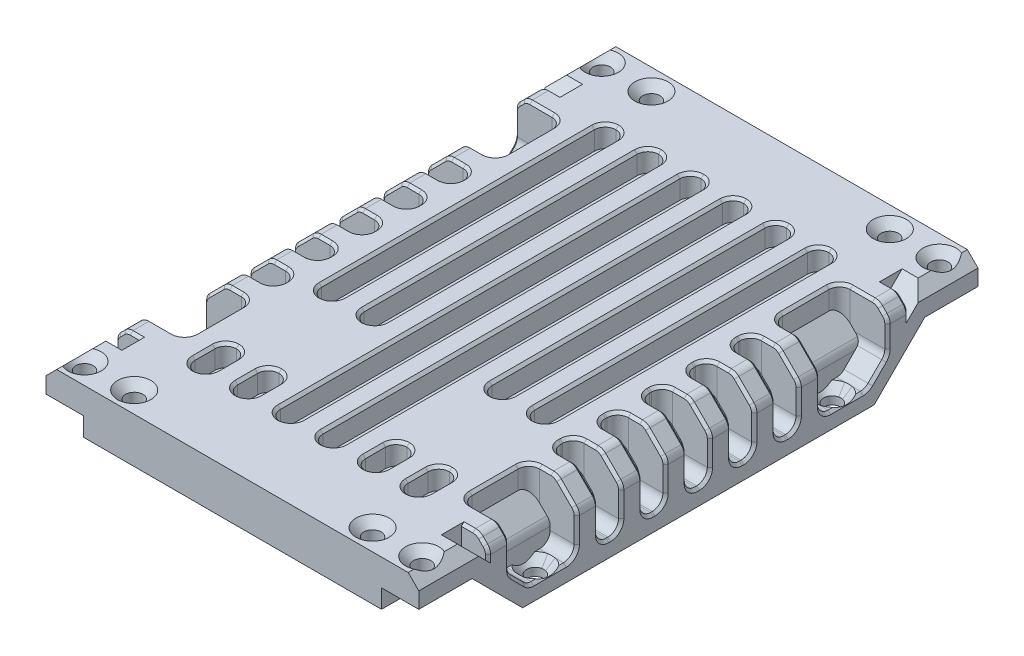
SolidWorks part; units mm, degrees
ref_plane "Front Plane" through (0, 0, 0) normal (0, 0, 1) x (1, 0, 0)
ref_plane "Top Plane" through (0, 0, 0) normal (0, 1, 0) x (1, 0, 0)
ref_plane "Right Plane" through (0, 0, 0) normal (1, 0, 0) x (0, 0, -1)
sketch "Sketch1" plane through (0, 0, 0) normal (0, 0, 1) x (1, 0, 0)
  line L0 (7, 0) -> (7, 6)
  line L1 (0, 0) -> (7, 0)
  line L2 (0, 0) -> (0, 14.5)
  line L3 (0, 14.5) -> (70, 14.5)
  line L4 (70, 0) -> (70, 14.5)
  line L5 (7, 6) -> (63, 6)
  line L6 (63, 6) -> (63, 0)
  line L7 (63, 0) -> (70, 0)
  dimension "D1" = 6
  dimension "D2" = 8.5
  dimension "D3" = 7
  dimension "D4" = 7
  dimension "D5" = 70
extrude "Boss-Extrude1" add sketch "Sketch1" along normal blind 105
sketch "Sketch2" plane through (70, 0, 0) normal (1, 0, 0) x (0, 0, -1)
  line L0 (0, 9.5) -> (-10, 9.5)
  line L1 (-10, 9.5) -> (-19.5, 0)
  line L2 (-19.5, 0) -> (-85.5, 0)
  line L3 (-85.5, 0) -> (-95, 9.5)
  line L4 (-95, 9.5) -> (-105, 9.5)
  line L5 (-105, 9.5) -> (-105, 14.5)
  line L6 (-105, 14.5) -> (0, 14.5)
  line L7 (0, 14.5) -> (0, 9.5)
  line L8 (0, 0) -> (-105, 14.5)
extrude "Cut-Extrude1" cut sketch "Sketch2" against normal through all contours L3 L4 M5 M6 | L8 L0 L1 M3 | L8 L1 M6
sketch "Sketch3" plane through (70, 0, 0) normal (1, 0, 0) x (0, 0, -1)
  line L0 (-9.2426, 14.5) -> (-20.7426, 3)
  line L1 (-20.7426, 3) -> (-84.2574, 3)
  line L2 (-84.2574, 3) -> (-95.7574, 14.5)
  line L3 (-95.7574, 14.5) -> (-9.2426, 14.5)
  line L5 (-105, 14.5) -> (0, 14.5) construction
  line L6 (-85.5, 0) -> (-95, 9.5) construction
  line L7 (-85.5, 0) -> (-19.5, 0) construction
  line L8 (-10, 9.5) -> (-19.5, 0) construction
extrude "Cut-Extrude2" cut sketch "Sketch3" against normal blind 5 contours L2 L3 L0 L1
ref_plane "Plane1" through (35, 0, 0) normal (1, 0, 0) x (0, 0, -1)
mirror "Mirror1" about plane through (35, 0, 0) normal (1, 0, 0) of "Cut-Extrude2"
sketch "Sketch4" plane through (0, 14.5, 0) normal (0, 1, 0) x (1, 0, 0)
  line L2 (0, -13) -> (0, -92)
  line L3 (0, -92) -> (70, -92)
  line L4 (70, -13) -> (70, -92)
  line L5 (70, -84.2574) -> (70, -95.7574) construction
  line L7 (70, -105) -> (0, -105) construction
  line L9 (9, -92) -> (13, -92)
  line L10 (9, -92) -> (9, -13)
  line L12 (13, -92) -> (13, -13)
  line L13 (17, -92) -> (17, -13)
  line L14 (21, -92) -> (21, -13)
  line L15 (25, -92) -> (25, -13)
  line L16 (29, -92) -> (29, -13)
  line L17 (33, -92) -> (33, -13)
  line L18 (37, -92) -> (37, -13)
  line L19 (41, -92) -> (41, -13)
  line L20 (45, -92) -> (45, -13)
  line L21 (49, -92) -> (49, -13)
  line L22 (53, -92) -> (53, -13)
  line L23 (57, -92) -> (57, -13)
  line L24 (61, -92) -> (61, -13)
  line L26 (61, -13) -> (70, -13)
  line L27 (0, -13) -> (9, -13)
  line L28 (0, -9.2426) -> (0, -20.7426) construction
  line L29 (9, -13) -> (61, -13)
  dimension "D1" = 4
  dimension "D2" = 13
  dimension "D4" = 4
  dimension "D3" = 7
extrude "Cut-Extrude3" cut sketch "Sketch4" against normal blind 4 contours L27 L3 L10 M3 | L29 L12 L3 L13 | L29 L14 L3 L15 | L29 L16 L3 L17 | L29 L18 L3 L19 | L29 L20 L3 L21 | L29 L22 L3 L23 | L26 L24 L3 M9
sketch "Sketch5" plane through (0, 14.5, 0) normal (0, 1, 0) x (1, 0, 0)
  line L1 (29, -84.2574) -> (13, -84.2574)
  line L2 (29, -84.2574) -> (29, -68.2574)
  line L3 (29, -68.2574) -> (13, -68.2574)
  line L4 (13, -84.2574) -> (13, -68.2574)
  line L6 (41, -68.2574) -> (57, -68.2574)
  line L7 (41, -68.2574) -> (41, -84.2574)
  line L8 (41, -84.2574) -> (57, -84.2574)
  line L9 (57, -68.2574) -> (57, -84.2574)
  line L10 (13, -92) -> (13, -13) construction
  line L11 (41, -92) -> (41, -13) construction
  line L12 (57, -92) -> (57, -13) construction
  line L13 (29, -92) -> (29, -13) construction
  line L14 (5, -84.2574) -> (0, -84.2574) construction
extrude "Boss-Extrude2" add sketch "Sketch5" against normal up to surface (4 mm away)
sketch "Sketch6" plane through (0, 14.5, 0) normal (0, 1, 0) x (1, 0, 0)
  line L0 (70, -84.2574) -> (70, -95.7574) construction
  line L1 (61, -92) -> (70, -92)
  line L2 (61, -92) -> (61, -88)
  line L3 (61, -88) -> (70, -88)
  line L4 (70, -92) -> (70, -88)
  line L5 (61, -83.6667) -> (70, -83.6667)
  line L6 (70, -83.6667) -> (70, -79.6667)
  line L7 (61, -79.6667) -> (70, -79.6667)
  line L8 (61, -83.6667) -> (61, -79.6667)
  line L9 (61, -75.3333) -> (70, -75.3333)
  line L10 (70, -75.3333) -> (70, -71.3333)
  line L11 (61, -71.3333) -> (70, -71.3333)
  line L12 (61, -75.3333) -> (61, -71.3333)
  line L13 (61, -67) -> (70, -67)
  line L14 (70, -67) -> (70, -63)
  line L15 (61, -63) -> (70, -63)
  line L16 (61, -67) -> (61, -63)
  line L17 (61, -58.6667) -> (70, -58.6667)
  line L18 (70, -58.6667) -> (70, -54.6667)
  line L19 (61, -54.6667) -> (70, -54.6667)
  line L20 (61, -58.6667) -> (61, -54.6667)
  line L21 (61, -50.3333) -> (70, -50.3333)
  line L22 (70, -50.3333) -> (70, -46.3333)
  line L23 (61, -46.3333) -> (70, -46.3333)
  line L24 (61, -50.3333) -> (61, -46.3333)
  line L25 (61, -42) -> (70, -42)
  line L26 (70, -42) -> (70, -38)
  line L27 (61, -38) -> (70, -38)
  line L28 (61, -42) -> (61, -38)
  line L29 (61, -33.6667) -> (70, -33.6667)
  line L30 (70, -33.6667) -> (70, -29.6667)
  line L31 (61, -29.6667) -> (70, -29.6667)
  line L32 (61, -33.6667) -> (61, -29.6667)
  line L33 (61, -25.3333) -> (70, -25.3333)
  line L34 (70, -25.3333) -> (70, -21.3333)
  line L35 (61, -21.3333) -> (70, -21.3333)
  line L36 (61, -25.3333) -> (61, -21.3333)
  line L37 (61, -17) -> (70, -17)
  line L38 (70, -17) -> (70, -13)
  line L39 (61, -13) -> (70, -13)
  line L40 (61, -17) -> (61, -13)
  line L41 (61, -13) -> (65, -13) construction
  dimension "D1" = 4
  dimension "D2" = 10
extrude "Boss-Extrude3" add sketch "Sketch6" against normal up to next
mirror "Mirror2" about plane through (35, 0, 0) normal (1, 0, 0) of "Boss-Extrude3"
chamfer "Chamfer1" distance 4 angle 45 26 edges at (65, 10.5, 23.3333) (70, 14.5, 31.6667) (65, 10.5, 35.8333) (70, 14.5, 40) (65, 10.5, 44.1667) (70, 14.5, 48.3333) (65, 10.5, 52.5) (70, 14.5, 56.6667) (65, 10.5, 69.1667) (65, 10.5, 81.6667) (65, 10.5, 60.8333) (70, 14.5, 65) (70, 14.5, 73.3333) (5, 10.5, 23.3333) (0, 14.5, 31.6667) (5, 10.5, 35.8333) (0, 14.5, 40) (5, 10.5, 44.1667) (0, 14.5, 48.3333) (5, 10.5, 52.5) (0, 14.5, 56.6667) (5, 10.5, 60.8333) (0, 14.5, 65) (5, 10.5, 69.1667) (0, 14.5, 73.3333) (5, 10.5, 81.6667)
chamfer "Chamfer2" distance 2 angle 45 8 edges at (70, 14.5, 100.3787) (70, 14.5, 90) (70, 14.5, 15) (70, 14.5, 4.6213) (0, 14.5, 15) (0, 14.5, 90) (0, 14.5, 100.3787) (0, 14.5, 4.6213)
fillet "Fillet1" radius 2 46 edges at (2.5, 3, 84.2574) (2.6213, 6.7426, 88) (0, 12.5, 90) (2, 14.5, 90) (9, 12.5, 88) (9, 12.5, 75.3333) (2.5, 3, 75.3333) (9, 12.5, 67) (2.5, 3, 67) (2.5, 3, 71.3333) (0, 10.5, 73.3333) (4, 14.5, 73.3333) (9, 12.5, 71.3333) (4, 14.5, 65) (0, 10.5, 65) (9, 12.5, 63) (2.5, 3, 63) (2.5, 3, 54.6667) (9, 12.5, 54.6667) (9, 12.5, 46.3333) (2.5, 3, 46.3333) (9, 12.5, 58.6667) (2.5, 3, 58.6667) (4, 14.5, 56.6667) (0, 10.5, 56.6667) (4, 14.5, 48.3333) (0, 10.5, 48.3333) (2.5, 3, 50.3333) (9, 12.5, 50.3333) (9, 12.5, 42) (2.5, 3, 42) (2.5, 3, 33.6667) (2.5, 3, 38) (2.5, 3, 29.6667) (2.5, 3, 20.7426) (2.6213, 6.7426, 17) (9, 12.5, 17) (9, 12.5, 29.6667) (9, 12.5, 33.6667) (9, 12.5, 38) (0, 10.5, 40) (4, 14.5, 40) (0, 10.5, 31.6667) (2, 14.5, 15) (0, 12.5, 15) (4, 14.5, 31.6667)
fillet "Fillet2" radius 2 40 edges at (53, 12.5, 68.2574) (45, 12.5, 68.2574) (37, 12.5, 92) (29, 12.5, 92) (57, 12.5, 68.2574) (49, 12.5, 68.2574) (41, 12.5, 92) (33, 12.5, 92) (17, 12.5, 68.2574) (25, 12.5, 68.2574) (21, 12.5, 68.2574) (13, 12.5, 68.2574) (57, 12.5, 13) (49, 12.5, 13) (41, 12.5, 13) (33, 12.5, 13) (25, 12.5, 13) (17, 12.5, 13) (13, 12.5, 13) (21, 12.5, 13) (53, 12.5, 13) (45, 12.5, 13) (37, 12.5, 13) (29, 12.5, 13) (21, 12.5, 92) (13, 12.5, 92) (53, 12.5, 92) (45, 12.5, 92) (13, 12.5, 84.2574) (21, 12.5, 84.2574) (53, 12.5, 84.2574) (45, 12.5, 84.2574) (57, 12.5, 84.2574) (49, 12.5, 84.2574) (25, 12.5, 84.2574) (17, 12.5, 84.2574) (57, 12.5, 92) (49, 12.5, 92) (25, 12.5, 92) (17, 12.5, 92)
fillet "Fillet3" radius 2 46 edges at (70, 10.5, 65) (61, 12.5, 63) (67.5, 3, 63) (61, 12.5, 71.3333) (67.5, 3, 71.3333) (61, 12.5, 33.6667) (67.5, 3, 33.6667) (67.5, 3, 42) (67.5, 3, 50.3333) (61, 12.5, 50.3333) (61, 12.5, 42) (61, 12.5, 38) (61, 12.5, 46.3333) (61, 12.5, 54.6667) (67.5, 3, 54.6667) (67.5, 3, 46.3333) (67.5, 3, 38) (68, 14.5, 15) (70, 12.5, 15) (67.5, 3, 29.6667) (61, 12.5, 29.6667) (61, 12.5, 17) (67.3787, 6.7426, 17) (67.5, 3, 20.7426) (70, 10.5, 31.6667) (66, 14.5, 31.6667) (66, 14.5, 40) (70, 10.5, 40) (70, 10.5, 48.3333) (66, 14.5, 48.3333) (66, 14.5, 56.6667) (61, 12.5, 58.6667) (61, 12.5, 67) (66, 14.5, 65) (70, 10.5, 56.6667) (67.5, 3, 58.6667) (67.5, 3, 67) (67.5, 3, 75.3333) (67.5, 3, 84.2574) (67.3787, 6.7426, 88) (61, 12.5, 88) (61, 12.5, 75.3333) (66, 14.5, 73.3333) (70, 10.5, 73.3333) (68, 14.5, 90) (70, 12.5, 90)
chamfer "Chamfer3" distance 0.5 angle 45 312 edges at (70, 11.2071, 13) (69.8478, 12.4369, 13) (66.0858, 14.5, 13) (69, 13.5, 13) (67.9369, 14.3478, 13) (70, 11.2071, 92) (66.0858, 14.5, 92) (69.8478, 12.4369, 92) (67.9369, 14.3478, 92) (69, 13.5, 92) (0, 11.2071, 13) (0.1522, 12.4369, 13) (1, 13.5, 13) (3.9142, 14.5, 13) (2.0631, 14.3478, 13) (3.9142, 14.5, 92) (2.0631, 14.3478, 92) (1, 13.5, 92) (0, 11.2071, 92) (0.1522, 12.4369, 92) (13, 14.5, 88.1287) (13.5858, 14.5, 91.4142) (13.5858, 14.5, 84.8431) (16.4142, 14.5, 91.4142) (16.4142, 14.5, 84.8431) (17, 14.5, 88.1287) (21, 14.5, 88.1287) (21.5858, 14.5, 91.4142) (21.5858, 14.5, 84.8431) (24.4142, 14.5, 91.4142) (24.4142, 14.5, 84.8431) (25, 14.5, 88.1287) (53, 14.5, 88.1287) (53.5858, 14.5, 91.4142) (53.5858, 14.5, 84.8431) (56.4142, 14.5, 91.4142) (56.4142, 14.5, 84.8431) (57, 14.5, 88.1287) (45, 14.5, 88.1287) (45.5858, 14.5, 91.4142) (45.5858, 14.5, 84.8431) (48.4142, 14.5, 91.4142) (48.4142, 14.5, 84.8431) (49, 14.5, 88.1287) (53, 14.5, 40.6287) (53.5858, 14.5, 67.6716) (53.5858, 14.5, 13.5858) (56.4142, 14.5, 67.6716) (56.4142, 14.5, 13.5858) (57, 14.5, 40.6287) (45, 14.5, 40.6287) (45.5858, 14.5, 67.6716) (45.5858, 14.5, 13.5858) (48.4142, 14.5, 67.6716) (48.4142, 14.5, 13.5858) (49, 14.5, 40.6287) (37, 14.5, 52.5) (37.5858, 14.5, 91.4142) (37.5858, 14.5, 13.5858) (40.4142, 14.5, 91.4142) (40.4142, 14.5, 13.5858) (41, 14.5, 52.5) (29, 14.5, 52.5) (29.5858, 14.5, 91.4142) (29.5858, 14.5, 13.5858) (32.4142, 14.5, 91.4142) (32.4142, 14.5, 13.5858) (33, 14.5, 52.5) (21, 14.5, 40.6287) (21.5858, 14.5, 67.6716) (21.5858, 14.5, 13.5858) (24.4142, 14.5, 67.6716) (24.4142, 14.5, 13.5858) (25, 14.5, 40.6287) (13, 14.5, 40.6287) (13.5858, 14.5, 67.6716) (13.5858, 14.5, 13.5858) (16.4142, 14.5, 67.6716) (16.4142, 14.5, 13.5858) (17, 14.5, 40.6287) (0, 7.3358, 33.6667) (0.1522, 10.4369, 33.6667) (0, 3.5858, 34.2525) (2, 12.5, 33.6667) (0, 3, 35.8333) (4.0631, 14.3478, 33.6667) (0, 3.5858, 37.4142) (5.9142, 14.5, 33.6667) (0, 7.3358, 38) (8.4142, 14.5, 34.2525) (0.1522, 10.4369, 38) (9, 14.5, 35.8333) (2, 12.5, 38) (8.4142, 14.5, 37.4142) (4.0631, 14.3478, 38) (5.9142, 14.5, 38) (0, 3.5858, 42.5858) (0, 7.3358, 42) (0, 3, 44.1667) (0.1522, 10.4369, 42) (0, 3.5858, 45.7475) (2, 12.5, 42) (0, 7.3358, 46.3333) (4.0631, 14.3478, 42) (0.1522, 10.4369, 46.3333) (5.9142, 14.5, 42) (2, 12.5, 46.3333) (8.4142, 14.5, 42.5858) (4.0631, 14.3478, 46.3333) (9, 14.5, 44.1667) (5.9142, 14.5, 46.3333) (8.4142, 14.5, 45.7475) (0, 7.3358, 50.3333) (0.1522, 10.4369, 50.3333) (0, 3.5858, 50.9191) (2, 12.5, 50.3333) (0, 3, 52.5) (4.0631, 14.3478, 50.3333) (0, 3.5858, 54.0809) (5.9142, 14.5, 50.3333) (0, 7.3358, 54.6667) (8.4142, 14.5, 50.9191) (0.1522, 10.4369, 54.6667) (9, 14.5, 52.5) (2, 12.5, 54.6667) (8.4142, 14.5, 54.0809) (4.0631, 14.3478, 54.6667) (5.9142, 14.5, 54.6667) (0, 7.3358, 58.6667) (0.1522, 10.4369, 58.6667) (0, 3.5858, 59.2525) (2, 12.5, 58.6667) (0, 3, 60.8333) (4.0631, 14.3478, 58.6667) (0, 3.5858, 62.4142) (5.9142, 14.5, 58.6667) (0, 7.3358, 63) (8.4142, 14.5, 59.2525) (0.1522, 10.4369, 63) (9, 14.5, 60.8333) (2, 12.5, 63) (8.4142, 14.5, 62.4142) (4.0631, 14.3478, 63) (5.9142, 14.5, 63) (0, 7.3358, 67) (0.1522, 10.4369, 67) (0, 3.5858, 67.5858) (2, 12.5, 67) (0, 3, 69.1667) (4.0631, 14.3478, 67) (0, 3.5858, 70.7475) (5.9142, 14.5, 67) (0, 7.3358, 71.3333) (8.4142, 14.5, 67.5858) (0.1522, 10.4369, 71.3333) (9, 14.5, 69.1667) (2, 12.5, 71.3333) (8.4142, 14.5, 70.7475) (4.0631, 14.3478, 71.3333) (5.9142, 14.5, 71.3333) (0, 3, 80.3811) (0, 3.5858, 75.9191) (0, 3.1522, 84.1943) (0, 7.3358, 75.3333) (0, 4.8713, 86.1287) (0.1522, 10.4369, 75.3333) (0, 6.8057, 87.8478) (2, 12.5, 75.3333) (0, 9.6213, 88) (4.0631, 14.3478, 75.3333) (0.1522, 12.4369, 88) (5.9142, 14.5, 75.3333) (1, 13.5, 88) (8.4142, 14.5, 75.9191) (2.0631, 14.3478, 88) (9, 14.5, 81.6667) (4.9142, 14.5, 88) (8.4142, 14.5, 87.4142) (0, 4.8713, 18.8713) (0, 6.8057, 17.1522) (0, 3.1522, 20.8057) (0, 9.6213, 17) (0, 3, 24.6189) (0.1522, 12.4369, 17) (0, 3.5858, 29.0809) (1, 13.5, 17) (0, 7.3358, 29.6667) (2.0631, 14.3478, 17) (0.1522, 10.4369, 29.6667) (4.9142, 14.5, 17) (2, 12.5, 29.6667) (8.4142, 14.5, 17.5858) (4.0631, 14.3478, 29.6667) (9, 14.5, 23.3333) (5.9142, 14.5, 29.6667) (8.4142, 14.5, 29.0809) (70, 3, 80.3811) (70, 3.1522, 84.1943) (70, 3.5858, 75.9191) (70, 4.8713, 86.1287) (70, 7.3358, 75.3333) (70, 6.8057, 87.8478) (69.8478, 10.4369, 75.3333) (70, 9.6213, 88) (68, 12.5, 75.3333) (69.8478, 12.4369, 88) (65.9369, 14.3478, 75.3333) (69, 13.5, 88) (64.0858, 14.5, 75.3333) (67.9369, 14.3478, 88) (61.5858, 14.5, 75.9191) (65.0858, 14.5, 88) (61, 14.5, 81.6667) (61.5858, 14.5, 87.4142) (70, 6.8057, 17.1522) (70, 9.6213, 17) (70, 4.8713, 18.8713) (69.8478, 12.4369, 17) (70, 3.1522, 20.8057) (69, 13.5, 17) (70, 3, 24.6189) (67.9369, 14.3478, 17) (70, 3.5858, 29.0809) (65.0858, 14.5, 17) (70, 7.3358, 29.6667) (61.5858, 14.5, 17.5858) (69.8478, 10.4369, 29.6667) (61, 14.5, 23.3333) (68, 12.5, 29.6667) (61.5858, 14.5, 29.0809) (65.9369, 14.3478, 29.6667) (64.0858, 14.5, 29.6667) (70, 7.3358, 33.6667) (69.8478, 10.4369, 33.6667) (70, 3.5858, 34.2525) (68, 12.5, 33.6667) (70, 3, 35.8333) (65.9369, 14.3478, 33.6667) (70, 3.5858, 37.4142) (64.0858, 14.5, 33.6667) (70, 7.3358, 38) (61.5858, 14.5, 34.2525) (69.8478, 10.4369, 38) (61, 14.5, 35.8333) (68, 12.5, 38) (61.5858, 14.5, 37.4142) (65.9369, 14.3478, 38) (64.0858, 14.5, 38) (70, 7.3358, 42) (69.8478, 10.4369, 42) (70, 3.5858, 42.5858) (68, 12.5, 42) (70, 3, 44.1667) (65.9369, 14.3478, 42) (70, 3.5858, 45.7475) (64.0858, 14.5, 42) (70, 7.3358, 46.3333) (61.5858, 14.5, 42.5858) (69.8478, 10.4369, 46.3333) (61, 14.5, 44.1667) (68, 12.5, 46.3333) (61.5858, 14.5, 45.7475) (65.9369, 14.3478, 46.3333) (64.0858, 14.5, 46.3333) (70, 7.3358, 67) (69.8478, 10.4369, 67) (70, 3.5858, 67.5858) (68, 12.5, 67) (70, 3, 69.1667) (65.9369, 14.3478, 67) (70, 3.5858, 70.7475) (64.0858, 14.5, 67) (70, 7.3358, 71.3333) (61.5858, 14.5, 67.5858) (69.8478, 10.4369, 71.3333) (61, 14.5, 69.1667) (68, 12.5, 71.3333) (61.5858, 14.5, 70.7475) (65.9369, 14.3478, 71.3333) (64.0858, 14.5, 71.3333) (70, 7.3358, 58.6667) (69.8478, 10.4369, 58.6667) (70, 3.5858, 59.2525) (68, 12.5, 58.6667) (70, 3, 60.8333) (65.9369, 14.3478, 58.6667) (70, 3.5858, 62.4142) (64.0858, 14.5, 58.6667) (70, 7.3358, 63) (61.5858, 14.5, 59.2525) (69.8478, 10.4369, 63) (61, 14.5, 60.8333) (68, 12.5, 63) (61.5858, 14.5, 62.4142) (65.9369, 14.3478, 63) (64.0858, 14.5, 63) (70, 7.3358, 50.3333) (69.8478, 10.4369, 50.3333) (70, 3.5858, 50.9191) (68, 12.5, 50.3333) (70, 3, 52.5) (65.9369, 14.3478, 50.3333) (70, 3.5858, 54.0809) (64.0858, 14.5, 50.3333) (70, 7.3358, 54.6667) (61.5858, 14.5, 50.9191) (69.8478, 10.4369, 54.6667) (61, 14.5, 52.5) (68, 12.5, 54.6667) (61.5858, 14.5, 54.0809) (65.9369, 14.3478, 54.6667) (64.0858, 14.5, 54.6667)
fillet "Fillet4" radius 2 14 edges at (5, 6.5, 81.5112) (5, 6.5, 69.1667) (5, 6.5, 60.8333) (5, 6.5, 52.5) (5, 6.5, 44.1667) (5, 6.5, 35.8333) (5, 6.5, 23.4888) (65, 6.5, 23.4888) (65, 6.5, 35.8333) (65, 6.5, 44.1667) (65, 6.5, 52.5) (65, 6.5, 60.8333) (65, 6.5, 69.1667) (65, 6.5, 81.5112)
sketch "Sketch7" plane through (0, 6, 0) normal (0, -1, 0) x (1, 0, 0)
  line L0 (0, 0) -> (70, 0) construction
  line L1 (7, 105) -> (63, 105)
  line L2 (7, 105) -> (7, 0)
  line L3 (7, 0) -> (63, 0)
  line L4 (63, 105) -> (63, 0)
  line L5 (63, 85.5) -> (63, 19.5) construction
extrude "Boss-Extrude4" add sketch "Sketch7" against normal up to next
sketch "Sketch8" plane through (0, 6, 0) normal (0, -1, 0) x (1, 0, 0)
  line L5 (7, 13.5) -> (7, 0) construction
  line L7 (63, 0) -> (63, 13.5) construction
  line L8 (7, 7.5) -> (63, 7.5)
  line L9 (63, 7.5) -> (63, 97.5)
  line L10 (63, 91.5) -> (63, 105) construction
  line L11 (63, 97.5) -> (7, 97.5)
  line L12 (7, 105) -> (7, 91.5) construction
  line L13 (7, 97.5) -> (7, 7.5)
  line L14 (19.5, 10) -> (50.5, 10) construction
  line L15 (8.5, 9) -> (61.5, 9)
  line L16 (8.5, 9) -> (8.5, 96)
  line L17 (8.5, 96) -> (61.5, 96)
  line L18 (61.5, 9) -> (61.5, 96)
  line L19 (19.5, 95) -> (50.5, 95) construction
  dimension "D1" = 1
  dimension "D2" = 1
  dimension "D3" = 1.5
  dimension "D4" = 1.5
  dimension "D5" = 1.5
  dimension "D6" = 1.5
extrude "Cut-Extrude4" cut sketch "Sketch8" against normal blind 1.5
sketch "Sketch9" plane through (0, 3, 0) normal (0, 1, 0) x (1, 0, 0)
  line L0 (68, 0) -> (2, 0) construction
  line L1 (2.75, -24.6189) -> (67.25, -24.6189) construction
  line L2 (2.75, -24.6189) -> (2.75, -80.3811) construction
  line L3 (2.75, -80.3811) -> (67.25, -80.3811) construction
  line L4 (67.25, -24.6189) -> (67.25, -80.3811) construction
  line L5 (0.5, -27.6667) -> (5, -27.6667) construction
  line L6 (0.5, -21.5711) -> (0.5, -27.6667) construction
  line L7 (0.5, -77.3333) -> (0.5, -83.4289) construction
  circle A0 centre (2.75, -24.6189) radius 1.625
  circle A1 centre (67.25, -24.6189) radius 1.625
  circle A2 centre (67.25, -80.3811) radius 1.625
  circle A3 centre (2.75, -80.3811) radius 1.625
  point P6 (35, 0)
  point P7 (35, -24.6189)
  point P17 (2.75, -27.6667)
  point P21 (0.5, -24.6189)
  point P24 (0.5, -80.3811)
  dimension "D1" = 3.25
extrude "Cut-Extrude5" cut sketch "Sketch9" against normal through all
sketch "Sketch10" plane through (0, 14.5, 0) normal (0, 1, 0) x (1, 0, 0)
  line L0 (0, -52.5) -> (70, -52.5) construction
  line L1 (68, 0) -> (2, 0) construction
  line L2 (68, -105) -> (2, -105) construction
  line L3 (0, -52.6667) -> (0, -52.3333) construction
  line L4 (35, -52.5) -> (35, 0) construction
  circle A0 centre (3.2954, -3.9413) radius 1.625
  circle A1 centre (66.7046, -3.9413) radius 1.625
  circle A2 centre (12.6235, -3.9413) radius 1.625
  circle A3 centre (57.3765, -3.9413) radius 1.625
  circle A4 centre (66.7046, -101.0587) radius 1.625
  circle A5 centre (57.3765, -101.0587) radius 1.625
  circle A6 centre (12.6235, -101.0587) radius 1.625
  circle A7 centre (3.2954, -101.0587) radius 1.625
  dimension "D1" = 3.25
extrude "Cut-Extrude6" cut sketch "Sketch10" against normal through all
chamfer "Chamfer4" distance 1.5 angle 45 12 edges at (67.25, 3, 26.2439) (67.25, 3, 82.0061) (2.75, 3, 82.0061) (2.75, 3, 26.2439) (4.9204, 14.5, 3.9413) (12.6235, 14.5, 5.5663) (65.0796, 14.5, 3.9413) (57.3765, 14.5, 5.5663) (57.3765, 14.5, 99.4337) (65.0796, 14.5, 101.0587) (12.6235, 14.5, 99.4337) (4.9204, 14.5, 101.0587)
equation "\"D2@Sketch3\"=\"D1@Sketch3\""
